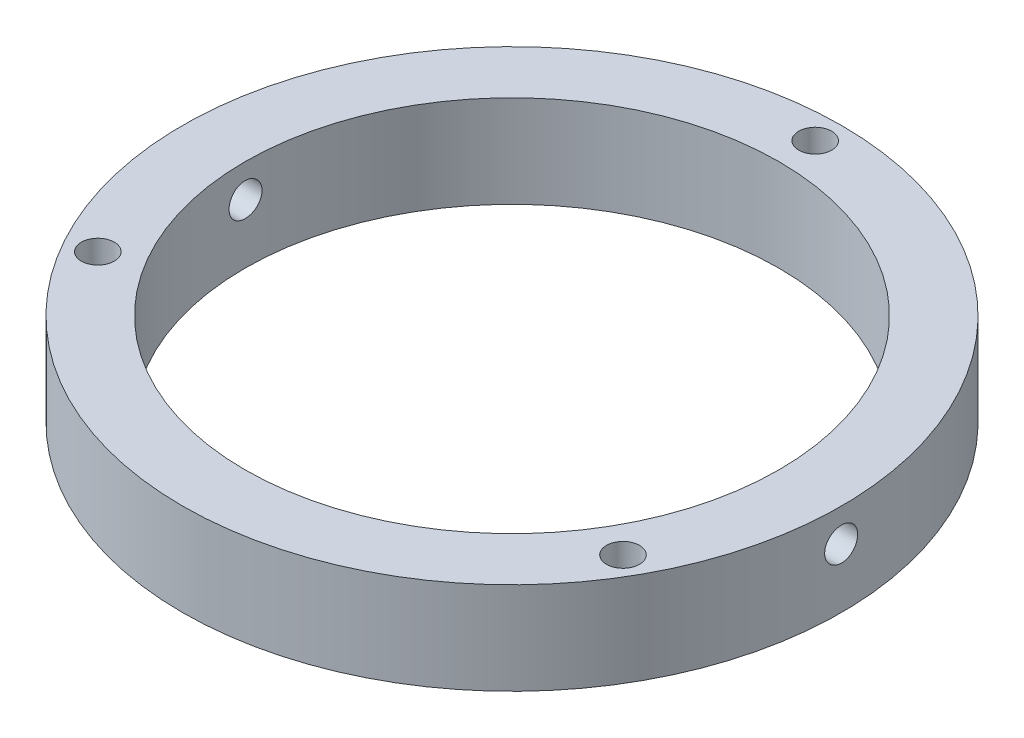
SolidWorks part; units mm, degrees
ref_plane "Front Plane" through (0, 0, 0) normal (0, 0, 1) x (1, 0, 0)
ref_plane "Top Plane" through (0, 0, 0) normal (0, 1, 0) x (1, 0, 0)
ref_plane "Right Plane" through (0, 0, 0) normal (1, 0, 0) x (0, 0, -1)
sketch "Sketch1" plane through (0, 0, 0) normal (0, 1, 0) x (1, 0, 0)
  circle A0 centre (0, 0) radius 25
  dimension "D1" = 50
extrude "Boss-Extrude1" add sketch "Sketch1" along normal blind 7
sketch "Sketch6" plane through (0, 7, 0) normal (0, 1, 0) x (1, 0, 0)
  circle A0 centre (0, 0) radius 20.25
  dimension "D1" = 40.5
extrude "Cut-Extrude3" cut sketch "Sketch6" against normal through all
hole_wizard "M3x0.5 Tapped Hole1" positions "Sketch8" profile "Sketch7" tap size "M3x0.5" standard "ANSI Metric"
sketch "Sketch8" plane through (0, 7, 0) normal (0, 1, 0) x (1, 0, 0)
  line L0 (0, 23) -> (0, 0) construction
  line L1 (0, 0) -> (19.9186, -11.5) construction
  line L3 (0, 0) -> (-19.9186, -11.5) construction
  point P0 (0, 23)
  point P2 (-19.9186, -11.5)
  point P4 (19.9186, -11.5)
  dimension "D1" = 120
  dimension "D2" = 120
  dimension "D3" = 23
sketch "Sketch7" plane through (0, 7, -23) normal (1, 0, 0) x (0, 0, 1)
  line L0 (0, 0) -> (0, 7)
  line L1 (0, 7) -> (1.25, 7)
  line L2 (1.25, 7) -> (1.25, 0)
  line L5 (1.25, 0) -> (0, 0)
  line L11 (0, -6.35) -> (0, 107.95) construction
  dimension "Thru Tap Drill Dia." = 2.5
  dimension "Thru Tap Drill Depth" = 7
ref_plane "Plane1" through (25, 0, 0) normal (1, 0, 0) x (0, 0, -1)
hole_wizard "M3x0.5 Tapped Hole2" positions "Sketch11" profile "Sketch10" tap size "M3x0.5" standard "ANSI Metric"
sketch "Sketch11" plane through (25, 0, 0) normal (1, 0, 0) x (0, 0, -1)
  line L0 (25, 7) -> (-25, 7) construction
  line L1 (0, 4.5) -> (0, 0) construction
  point P0 (0, 4.5)
  dimension "D1" = 2.5
sketch "Sketch10" plane through (25, 4.5, 0) normal (0, 1, 0) x (0, 0, -1)
  line L0 (0, 0) -> (0, 50)
  line L1 (0, 50) -> (1.25, 50)
  line L2 (1.25, 50) -> (1.25, 0)
  line L5 (1.25, 0) -> (0, 0)
  line L11 (0, -6.35) -> (0, 107.95) construction
  dimension "Thru Tap Drill Dia." = 2.5
  dimension "Thru Tap Drill Depth" = 50
